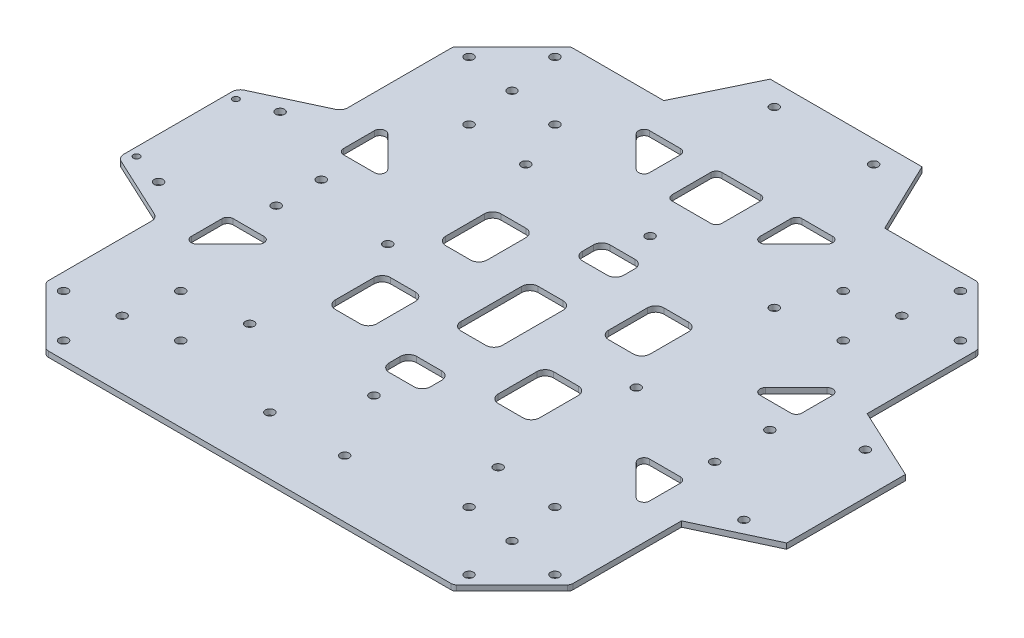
SolidWorks part; units mm, degrees
ref_plane "前视基准面" through (0, 0, 0) normal (0, 0, 1) x (1, 0, 0)
ref_plane "上视基准面" through (0, 0, 0) normal (0, 1, 0) x (1, 0, 0)
ref_plane "右视基准面" through (0, 0, 0) normal (1, 0, 0) x (0, 0, -1)
other "Configuration Table"
sketch "草图1" plane through (0, 0, 0) normal (0, 1, 0) x (1, 0, 0)
  line L0 (0, 0) -> (0, 165.603) construction
  line L1 (95, -73.7868) -> (95, 73.7868)
  line L2 (95, 73.7868) -> (73.7868, 95)
  line L3 (73.7868, 95) -> (-73.7868, 95)
  line L4 (-73.7868, 95) -> (-95, 73.7868)
  line L5 (-95, 73.7868) -> (-95, -73.7868)
  line L6 (-95, -73.7868) -> (-73.7868, -95)
  line L7 (-73.7868, -95) -> (73.7868, -95)
  line L8 (73.7868, -95) -> (95, -73.7868)
  line L9 (0, 0) -> (213.7391, 0) construction
  line L10 (-88.9896, -73.4332) -> (-52.22, -67.7764) construction
  line L11 (-73.4332, -88.9896) -> (-67.7764, -52.22) construction
  circle A0 centre (-88.9896, -73.4332) radius 1.6
  circle A1 centre (-73.4332, -88.9896) radius 1.6
  circle A2 centre (-73.4332, 88.9896) radius 1.6
  circle A3 centre (-88.9896, 73.4332) radius 1.6
  circle A4 centre (73.4332, 88.9896) radius 1.6
  circle A5 centre (88.9896, 73.4332) radius 1.6
  circle A6 centre (88.9896, -73.4332) radius 1.6
  circle A7 centre (73.4332, -88.9896) radius 1.6
  circle A9 centre (-67.7764, -52.22) radius 1.6
  circle A10 centre (-52.22, -67.7764) radius 1.6
  circle A11 centre (67.7764, -52.22) radius 1.6
  circle A12 centre (52.22, -67.7764) radius 1.6
  circle A13 centre (67.7764, 52.22) radius 1.6
  circle A14 centre (52.22, 67.7764) radius 1.6
  circle A15 centre (-67.7764, 52.22) radius 1.6
  circle A16 centre (-52.22, 67.7764) radius 1.6
  circle A17 centre (-70.6048, -70.6048) radius 1.6
  circle A18 centre (-70.6048, 70.6048) radius 1.6
  circle A19 centre (70.6048, -70.6048) radius 1.6
  circle A20 centre (70.6048, 70.6048) radius 1.6
  dimension "D5" = 3.2
  dimension "D6" = 3.2
  dimension "D7" = 3.2
  dimension "D1" = 190
  dimension "D2" = 190
  dimension "D3" = 30
  dimension "D4" = 135
extrude "凸台-拉伸1" add sketch "草图1" along normal blind 2 contours L8 A7 A6 L1 L2 A5 A4 L3 L4 A2 A3 L5 L6 A0 A1 L7 A15 A14 A13 A11 A10 A9 A12 A16
fillet "圆角1" radius 2 8 edges at (95, 1, -73.7868) (95, 1, 73.7868) (73.7868, 1, 95) (-73.7868, 1, 95) (-95, 1, -73.7868) (-73.7868, 1, -95) (73.7868, 1, -95) (-95, 1, 73.7868)
sketch "草图2" plane through (0, 2, 0) normal (0, 1, 0) x (1, 0, 0)
  line L0 (0, 95) -> (0, -95) construction
  line L1 (72.9584, 95) -> (-72.9584, 95) construction
  line L2 (-72.9584, -95) -> (72.9584, -95) construction
  line L3 (-20, -65) -> (-38, -83) construction
  line L4 (-38, -83) -> (-20, -83) construction
  line L5 (-20, -83) -> (-20, -65) construction
  line L6 (38, -83) -> (20, -83) construction
  line L7 (20, -65) -> (38, -83) construction
  line L8 (20, -83) -> (20, -65) construction
  line L9 (-65, 20) -> (-83, 38)
  line L10 (-9, -83) -> (9, -83) construction
  line L11 (-9, -83) -> (-9, -65) construction
  line L12 (-9, -65) -> (9, -65) construction
  line L13 (9, -83) -> (9, -65) construction
  line L14 (-83, 38) -> (-83, 20)
  line L15 (-83, 20) -> (-65, 20)
  line L16 (-83, -38) -> (-83, -20)
  line L17 (-65, -20) -> (-83, -38)
  line L18 (-83, -20) -> (-65, -20)
  line L19 (-83, 9) -> (-83, -9) construction
  line L20 (-83, 9) -> (-65, 9) construction
  line L21 (-65, 9) -> (-65, -9) construction
  line L22 (-83, -9) -> (-65, -9) construction
  line L23 (20, 65) -> (38, 83)
  line L24 (38, 83) -> (20, 83)
  line L25 (20, 83) -> (20, 65)
  line L26 (-38, 83) -> (-20, 83)
  line L27 (-20, 65) -> (-38, 83)
  line L28 (-20, 83) -> (-20, 65)
  line L29 (9, 83) -> (-9, 83)
  line L30 (9, 83) -> (9, 65)
  line L31 (9, 65) -> (-9, 65)
  line L32 (-9, 83) -> (-9, 65)
  line L33 (65, -20) -> (83, -38)
  line L34 (83, -38) -> (83, -20)
  line L35 (83, -20) -> (65, -20)
  line L36 (83, 38) -> (83, 20)
  line L37 (65, 20) -> (83, 38)
  line L38 (83, 20) -> (65, 20)
  line L39 (83, -9) -> (83, 9) construction
  line L40 (83, -9) -> (65, -9) construction
  line L41 (65, -9) -> (65, 9) construction
  line L42 (83, 9) -> (65, 9) construction
  point P49 (0, 0)
  dimension "D1" = 20
  dimension "D2" = 18
  dimension "D3" = 12
  dimension "D4" = 11
  dimension "D5" = 4
extrude "切除-拉伸1" cut sketch "草图2" against normal through all
fillet "圆角2" radius 2 22 edges at (38, 1, -83) (20, 1, -65) (20, 1, -83) (-20, 1, -83) (-20, 1, -65) (-38, 1, -83) (-9, 1, -65) (-9, 1, -83) (9, 1, -83) (9, 1, -65) (-83, 1, 20) (-65, 1, 20) (-83, 1, -38) (-65, 1, -20) (-83, 1, -20) (83, 1, -20) (65, 1, -20) (83, 1, -38) (83, 1, 38) (65, 1, 20) (83, 1, 20) (-83, 1, 38)
sketch "草图4" plane through (0, 2, 0) normal (0, 1, 0) x (1, 0, 0)
  line L0 (0, 0) -> (0, 123) construction
  line L1 (72.9584, 95) -> (-72.9584, 95) construction
  line L2 (-21.5, 121) -> (-33.624, 95) construction
  line L3 (-21.5, 95) -> (21.5, 95) construction
  line L5 (-21.5, 121) -> (21.5, 121) construction
  line L7 (-33.624, 95) -> (-21.5, 95) construction
  line L8 (21.5, 121) -> (33.624, 95) construction
  line L9 (33.624, 95) -> (21.5, 95) construction
  line L16 (21.5, -121) -> (33.624, -95) construction
  line L17 (21.5, -95) -> (-21.5, -95) construction
  line L18 (21.5, -121) -> (-21.5, -121) construction
  line L19 (33.624, -95) -> (21.5, -95) construction
  line L20 (-21.5, -121) -> (-33.624, -95) construction
  line L21 (-33.624, -95) -> (-21.5, -95) construction
  line L22 (-121, -21.5) -> (-95, -33.624)
  line L23 (-95, -21.5) -> (-95, 21.5)
  line L24 (-121, -21.5) -> (-121, 21.5)
  line L25 (-95, -33.624) -> (-95, -21.5)
  line L26 (-121, 21.5) -> (-95, 33.624)
  line L27 (-95, 33.624) -> (-95, 21.5)
  line L28 (121, 21.5) -> (95, 33.624)
  line L29 (95, 21.5) -> (95, -21.5)
  line L30 (121, 21.5) -> (121, -21.5)
  line L31 (95, 33.624) -> (95, 21.5)
  line L32 (121, -21.5) -> (95, -33.624)
  line L33 (95, -33.624) -> (95, -21.5)
  line L34 (95, 33.624) -> (95, 21.5)
  line L36 (121, 21.5) -> (95, 33.624)
  line L37 (95, -33.624) -> (95, -21.5)
  line L38 (121, -21.5) -> (121, 21.5)
  line L39 (95, -21.5) -> (95, 21.5)
  line L40 (121, -21.5) -> (95, -33.624)
  point P32 (0, 0)
  dimension "D1" = 28
  dimension "D2" = 43
  dimension "D3" = 26
  dimension "D4" = 65
  dimension "D5" = 26
  dimension "D6" = 4
extrude "凸台-拉伸2" add sketch "草图4" against normal up to surface (2 mm away)
fillet "圆角3" radius 3 4 edges at (-121, 1, -21.5) (-121, 1, 21.5) (-95, 1, 33.624) (-95, 1, -33.624)
sketch "草图5" plane through (0, 0, 0) normal (0, -1, 0) x (1, 0, 0)
  line L0 (0, -121) -> (0, 0) construction
  line L3 (-21, -121) -> (21, -121) construction
  line L4 (-21, -121) -> (-21, -79) construction
  line L5 (-21, -79) -> (21, -79) construction
  line L6 (21, -121) -> (21, -79) construction
  line L46 (77.5, 0) -> (-77.5, 0) construction
  line L47 (-37, -10) -> (-22, -10)
  line L48 (-77.25, 8.16) -> (-46.75, 8.16) construction
  line L65 (-77.25, 8.16) -> (-77.25, -8.16) construction
  line L66 (-77.25, -8.16) -> (-46.75, -8.16) construction
  line L67 (-46.75, 8.16) -> (-46.75, -8.16) construction
  line L68 (-7.5, -14) -> (7.5, -14)
  line L69 (-62, 9) -> (-62, -9) construction
  line L71 (72.9584, -95) -> (-72.9584, -95) construction
  line L72 (-7.5, -14) -> (-7.5, 14)
  line L73 (-7.5, 14) -> (7.5, 14)
  line L74 (7.5, -14) -> (7.5, 14)
  line L75 (-7.5, -14) -> (7.5, 14) construction
  line L76 (-7.5, 14) -> (7.5, -14) construction
  line L77 (-37, 30) -> (-22, 30)
  line L78 (-37, 30) -> (-37, 10)
  line L79 (-37, 10) -> (-22, 10)
  line L80 (-22, 30) -> (-22, 10)
  line L81 (-22, -30) -> (-22, -10)
  line L82 (-37, -30) -> (-22, -30)
  line L83 (-37, -30) -> (-37, -10)
  line L84 (37, 10) -> (22, 10)
  line L85 (22, 30) -> (22, 10)
  line L86 (37, 30) -> (22, 30)
  line L87 (37, 30) -> (37, 10)
  line L88 (37, -30) -> (37, -10)
  line L89 (37, -30) -> (22, -30)
  line L90 (22, -30) -> (22, -10)
  line L91 (37, -10) -> (22, -10)
  line L92 (-7.5, -40) -> (7.5, -40)
  line L93 (-7.5, 30) -> (7.5, 30)
  line L94 (-7.5, 30) -> (-7.5, 40)
  line L95 (-7.5, 40) -> (7.5, 40)
  line L96 (7.5, 30) -> (7.5, 40)
  line L97 (-7.5, 30) -> (7.5, 40) construction
  line L98 (-7.5, 40) -> (7.5, 30) construction
  line L99 (7.5, -30) -> (7.5, -40)
  line L100 (-7.5, -30) -> (7.5, -30)
  line L101 (-7.5, -30) -> (-7.5, -40)
  line L102 (0, 95) -> (0, 52.1919) construction
  line L103 (-72.9584, 95) -> (72.9584, 95) construction
  line L104 (13.55, 74.15) -> (-13.55, 74.15) construction
  circle A0 centre (-10.8959, -82.5) radius 1.6 construction
  circle A1 centre (9.1041, -82.5) radius 1.6 construction
  circle A2 centre (22, -106) radius 1.6 construction
  circle A3 centre (-22, -106) radius 1.6 construction
  circle A60 centre (-106, 22) radius 1.6
  circle A61 centre (-82.5, 10.8959) radius 1.6 construction
  circle A62 centre (-82.5, -9.1041) radius 1.6 construction
  circle A63 centre (-106, -22) radius 1.6
  circle A64 centre (22, 106) radius 1.6 construction
  circle A65 centre (10.8959, 82.5) radius 1.6 construction
  circle A66 centre (-9.1041, 82.5) radius 1.6 construction
  circle A67 centre (-22, 106) radius 1.6 construction
  circle A68 centre (106, -22) radius 1.6
  circle A69 centre (82.5, -10.8959) radius 1.6 construction
  circle A70 centre (82.5, 9.1041) radius 1.6 construction
  circle A71 centre (106, 22) radius 1.6
  circle A72 centre (-82.5, 10.8959) radius 1.6 construction
  circle A73 centre (-82.5, -9.1041) radius 1.6 construction
  circle A74 centre (10.8959, 82.5) radius 1.6 construction
  circle A75 centre (-9.1041, 82.5) radius 1.6 construction
  circle A76 centre (82.5, -10.8959) radius 1.6
  circle A77 centre (82.5, 9.1041) radius 1.6
  circle A78 centre (-77.25, 8.16) radius 1.6
  circle A79 centre (-46.75, 8.16) radius 1.6 construction
  circle A80 centre (-46.75, -8.16) radius 1.6 construction
  circle A81 centre (-77.25, -8.16) radius 1.6
  circle A82 centre (13.55, 74.15) radius 1.6
  circle A83 centre (-13.55, 74.15) radius 1.6
  point P2 (0, 74.15)
  point P32 (0, 35)
  point P156 (0, 0)
  point P169 (0, 0)
  dimension "D1" = 3.2
  dimension "D5" = 15
  dimension "D6" = 3.2
  dimension "D10" = 3.2
  dimension "D11" = 3.2
  dimension "D2" = 42
  dimension "D3" = 42
  dimension "D4" = 22
  dimension "D9" = 30.5
  dimension "D12" = 15
  dimension "D13" = 28
  dimension "D14" = 15
  dimension "D15" = 20
  dimension "D16" = 22
  dimension "D17" = 10
  dimension "D18" = 16
  dimension "D19" = 10
  dimension "D20" = 15
  dimension "D21" = 18
  dimension "D22" = 62
  dimension "D23" = 16.32
  dimension "D24" = 26
  dimension "D25" = 27.1
  dimension "D26" = 20.85
  dimension "D7" = 4
  dimension "D8" = 4
extrude "切除-拉伸3" cut sketch "草图5" against normal blind 10
fillet "圆角4" radius 3 28 edges at (-7.5, 1, -30) (7.5, 1, -30) (7.5, 1, -40) (-7.5, 1, -40) (22, 1, -30) (22, 1, -10) (37, 1, -10) (37, 1, -30) (7.5, 1, -14) (-7.5, 1, -14) (-7.5, 1, 14) (7.5, 1, 14) (7.5, 1, 30) (-7.5, 1, 30) (-7.5, 1, 40) (7.5, 1, 40) (-22, 1, 30) (-22, 1, 10) (-37, 1, 10) (-37, 1, -10) (-22, 1, -10) (-22, 1, -30) (-37, 1, -30) (37, 1, 10) (22, 1, 10) (22, 1, 30) (37, 1, 30) (-37, 1, 30)
sketch "草图6" plane through (0, 0, 0) normal (0, -1, 0) x (1, 0, 0)
  line L0 (-118, 18) -> (-118, -18) construction
  line L2 (-121, 0) -> (-102.1382, 0) construction
  line L4 (-121, 19.5888) -> (-121, -19.5888) construction
  circle A0 centre (-118, 18) radius 1.15
  circle A1 centre (-118, -18) radius 1.15
  point P7 (-118, 0)
  dimension "D2" = 2.3
  dimension "D1" = 36
  dimension "D3" = 3
extrude "激光安装孔" cut sketch "草图6" against normal blind 10
sketch "草图7" plane through (0, 2, 0) normal (0, 1, 0) x (1, 0, 0)
  line L0 (-40, 95) -> (-27.5, 121)
  line L1 (72.9584, 95) -> (-72.9584, 95) construction
  line L2 (-27.5, 121) -> (27.5, 121)
  line L3 (27.5, 121) -> (40, 95)
  line L4 (-40, 95) -> (40, 95)
  line L5 (0, 0) -> (0, 95) construction
  line L6 (0, 95) -> (0, 121) construction
  line L7 (18, 113) -> (-18, 113) construction
  circle A0 centre (18, 113) radius 1.6
  circle A1 centre (-18, 113) radius 1.6
  dimension "D5" = 3.2
  dimension "D1" = 80
  dimension "D2" = 55
  dimension "D3" = 26
  dimension "D4" = 36
  dimension "D6" = 8
extrude "凸台-拉伸3" add sketch "草图7" against normal up to surface (2 mm away)
sketch "草图8" plane through (0, 2, 0) normal (0, 1, 0) x (1, 0, 0)
  line L1 (-45, 50) -> (45, 50) construction
  line L2 (-45, 50) -> (-45, -50) construction
  line L3 (-45, -50) -> (45, -50) construction
  line L4 (45, 50) -> (45, -50) construction
  line L5 (-45, 50) -> (45, -50) construction
  line L6 (-45, -50) -> (45, 50) construction
  circle A0 centre (-45, 50) radius 1.6
  circle A1 centre (-45, -50) radius 1.6
  circle A2 centre (45, -50) radius 1.6
  circle A3 centre (45, 50) radius 1.6
  circle A4 centre (0, -50) radius 1.6
  circle A5 centre (0, 50) radius 1.6
  circle A6 centre (45, 0) radius 1.6
  circle A7 centre (-45, 0) radius 1.6
  point P0 (0, 0)
  dimension "D3" = 3.2
  dimension "D1" = 90
  dimension "D2" = 100
extrude "切除-拉伸4" cut sketch "草图8" against normal blind 10
